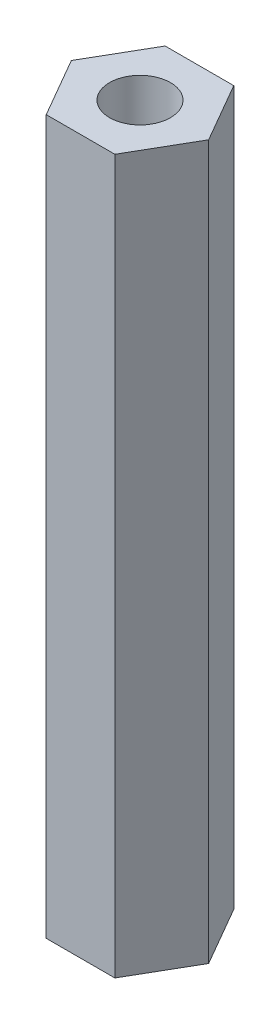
SolidWorks part; units mm, degrees
ref_plane "Front Plane" through (0, 0, 0) normal (0, 0, 1) x (1, 0, 0)
ref_plane "Top Plane" through (0, 0, 0) normal (0, 1, 0) x (1, 0, 0)
ref_plane "Right Plane" through (0, 0, 0) normal (1, 0, 0) x (0, 0, -1)
sketch "Sketch1" plane through (0, 0, 0) normal (0, 1, 0) x (1, 0, 0)
  line L1 (1.8331, 3.175) -> (-1.8331, 3.175)
  line L2 (-1.8331, 3.175) -> (-3.6662, 0)
  line L3 (-3.6662, 0) -> (-1.8331, -3.175)
  line L4 (-1.8331, -3.175) -> (1.8331, -3.175)
  line L5 (1.8331, -3.175) -> (3.6662, 0)
  line L6 (3.6662, 0) -> (1.8331, 3.175)
  circle A0 centre (0, 0) radius 3.175 construction
  circle A1 centre (0, 0) radius 1.6256
  dimension "D2" = 3.2512
  dimension "D1" = 6.35
extrude "Boss-Extrude1" add sketch "Sketch1" along normal blind 38.1
